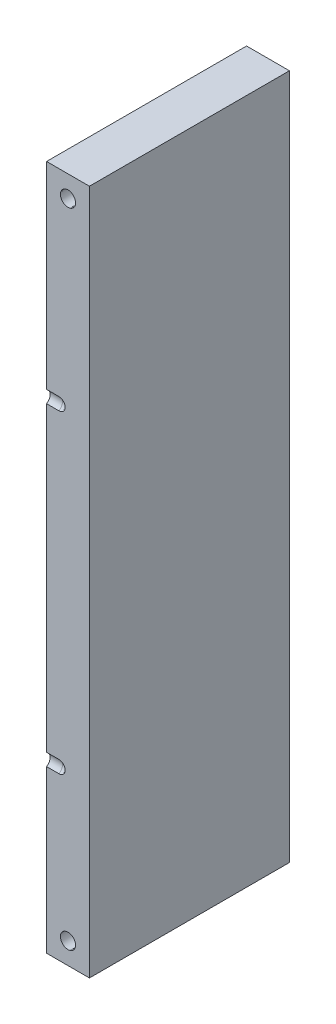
SolidWorks part; units mm, degrees
ref_plane "Front" through (0, 0, 0) normal (0, 0, 1) x (1, 0, 0)
ref_plane "Top" through (0, 0, 0) normal (0, 1, 0) x (1, 0, 0)
ref_plane "Right" through (0, 0, 0) normal (1, 0, 0) x (0, 0, -1)
sketch "Sketch1" plane through (0, 0, 0) normal (0, 0, 1) x (1, 0, 0)
  line L0 (-1219.2, -304.8) -> (0, -304.8) construction
  line L1 (-228.6, 304.8) -> (-266.7, 304.8)
  line L2 (-228.6, 304.8) -> (-228.6, -304.8)
  line L3 (-228.6, -304.8) -> (-266.7, -304.8)
  line L4 (-266.7, 304.8) -> (-266.7, -304.8)
  line L5 (0, 304.8) -> (-1219.2, 304.8) construction
  line L6 (-50.8, 304.8) -> (-50.8, -304.8) construction
  dimension "D1" = 38.1
  dimension "D2" = 177.8
extrude "Boss-Extrude1" add sketch "Sketch1" along normal blind 177.8 separate body
ref_plane "Plane1" through (-247.65, 0, 0) normal (1, 0, 0) x (0, 0, -1)
hole_wizard "Hole1" positions "Point_Sketch" profile "Profil_Sketch" tap size "5/8-11" standard "ANSI Inch"
sketch "Point_Sketch" plane through (-261.8635, -301.9822, 177.8) normal (0, 0, 1) x (1, 0, 0)
  point P0 (14.2135, 16.2322)
  point P2 (14.2135, 587.7322)
sketch "Profil_Sketch" plane through (-247.65, -285.75, 177.8) normal (1, 0, 0) x (0, -1, 0)
  line L0 (0, 0) -> (0, 59.6803)
  line L1 (0, 59.6803) -> (6.7475, 55.626)
  line L2 (6.7475, 55.626) -> (6.7475, 0)
  line L5 (6.7475, 0) -> (0, 0)
  line L10 (0, 59.6803) -> (-6.7475, 55.626) construction
  line L11 (0, -6.35) -> (0, 107.95) construction
  dimension "Tap Drill Dia." = 13.495
  dimension "Tap Drill Depth" = 55.626
  dimension "Drill Angle" = 118
other "usin_TS240_.625-11x3.5-SHCS<1>"
sketch "Sketch2" plane through (0, 0, 177.8) normal (0, 0, 1) x (1, 0, 0)
  circle A0 centre (-250.19, 123.825) radius 11.9063 construction
  circle A1 centre (-250.19, 123.825) radius 11.9062 construction
  circle A2 centre (-259.715, -155.575) radius 9.5504 construction
  circle A3 centre (-259.715, -155.575) radius 9.5504 construction
sketch "Sketch3" plane through (-266.7, 0, 0) normal (-1, 0, 0) x (0, 0, 1)
  line L0 (177.8, 304.8) -> (177.8, -304.8) construction
  circle A0 centre (180.975, 123.825) radius 6.35
  circle A1 centre (180.975, -155.575) radius 6.35
  dimension "D1" = 3.175
  dimension "D2" = 12.7
extrude "Cut-Extrude1" cut sketch "Sketch3" against normal up to vertex
fillet "Fillet1" radius 6.35 2 edges at (-250.19, 123.825, 174.625) (-250.19, -155.575, 174.625)
